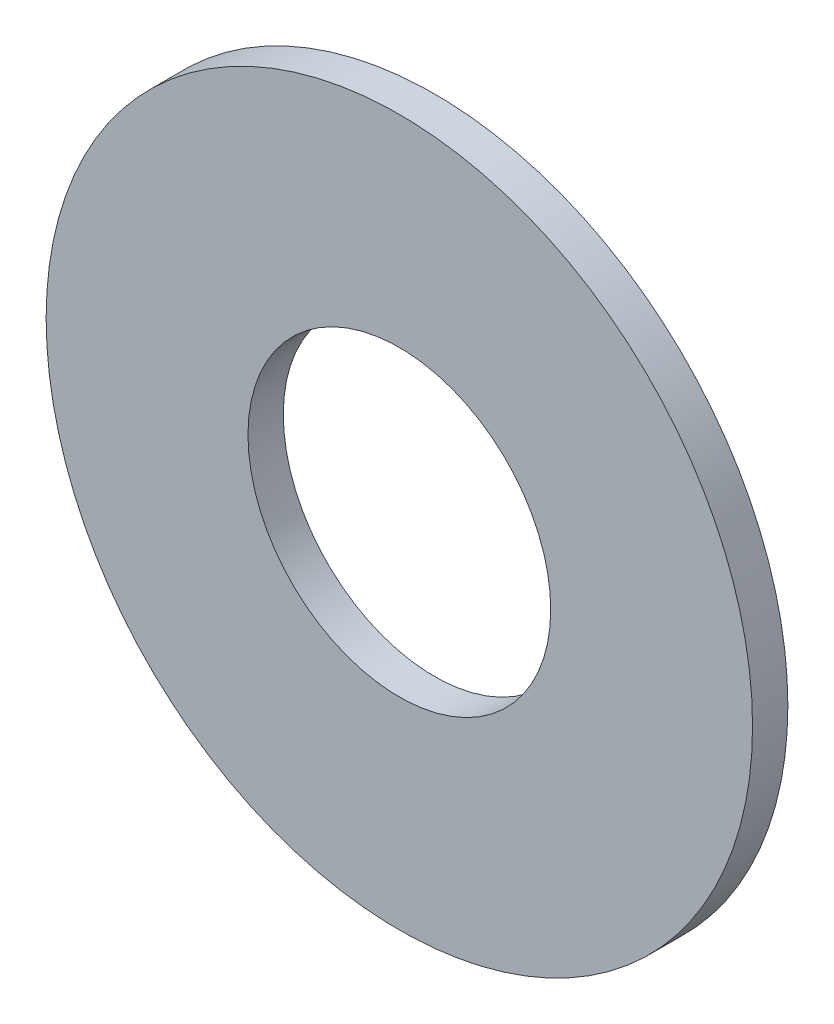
SolidWorks part; units mm, degrees
ref_plane "Face" through (0, 0, 0) normal (0, 0, 1) x (1, 0, 0)
ref_plane "Dessus" through (0, 0, 0) normal (0, 1, 0) x (1, 0, 0)
ref_plane "Droite" through (0, 0, 0) normal (1, 0, 0) x (0, 0, -1)
sketch "Esquisse1" plane through (0, 0, 0) normal (0, 0, 1) x (1, 0, 0)
  circle A0 centre (45, 0) radius 6
  circle A1 centre (45, 0) radius 14
  circle A2 centre (45, 0) radius 14 construction
  dimension "D1" = 12
extrude "Base-Extrusion" add sketch "Esquisse1" along normal blind 1.4
